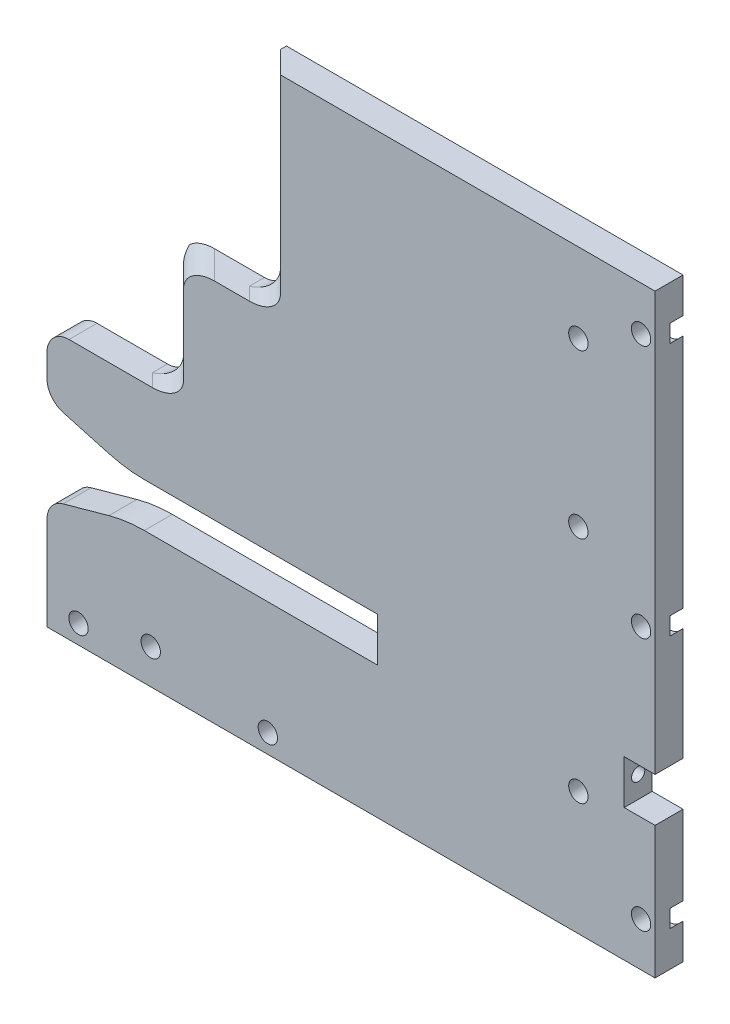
SolidWorks part; units mm, degrees
ref_plane "Front Plane" through (0, 0, 0) normal (0, 0, 1) x (1, 0, 0)
ref_plane "Top Plane" through (0, 0, 0) normal (0, 1, 0) x (1, 0, 0)
ref_plane "Right Plane" through (0, 0, 0) normal (1, 0, 0) x (0, 0, -1)
sketch "Sketch1" plane through (0, 0, 0) normal (0, 0, 1) x (1, 0, 0)
  line L0 (0, 0) -> (-138, 0)
  line L1 (-138, 0) -> (-138, 30)
  line L2 (-138, 30) -> (-63, 30)
  line L3 (-63, 30) -> (-63, 40)
  line L4 (-63, 40) -> (-138, 40)
  line L5 (-138, 40) -> (-138, 59)
  line L6 (-138, 59) -> (-112, 59)
  line L7 (-112, 59) -> (-112, 87)
  line L8 (-112, 87) -> (-90, 87)
  line L9 (-90, 87) -> (-90, 135)
  line L10 (-90, 135) -> (0, 135)
  line L11 (0, 135) -> (0, 0)
  point P10 (-120, 40)
  point P14 (-120, 30)
  dimension "D1" = 30
  dimension "D2" = 138
  dimension "D3" = 75
  dimension "D4" = 10
  dimension "D5" = 19
  dimension "D6" = 26
  dimension "D7" = 28
  dimension "D8" = 135
  dimension "D9" = 22
  dimension "D10" = 18
extrude "Boss-Extrude1" add sketch "Sketch1" along normal blind 6.35
sketch "Sketch4" plane through (0, 0, 0) normal (0, 0, -1) x (-1, 0, 0)
  line L0 (120, 40) -> (138, 45)
  line L1 (138, 40) -> (138, 59) construction
  line L2 (138, 45) -> (138, 40)
  line L3 (138, 40) -> (120, 40)
  line L4 (120, 30) -> (138, 30)
  line L5 (138, 30) -> (138, 25)
  line L6 (138, 0) -> (138, 30) construction
  line L7 (138, 25) -> (120, 30)
  dimension "D1" = 5
  dimension "D2" = 5
extrude "Cut-Extrude1" cut sketch "Sketch4" against normal through all
sketch "Sketch5" plane through (-63, 0, 0) normal (-1, 0, 0) x (0, 0, 1)
  line L0 (6.35, 30) -> (0, 30) construction
  circle A0 centre (3.175, 35) radius 1.5
  point P5 (3.175, 30)
  dimension "D1" = 3
extrude "Cut-Extrude2" cut sketch "Sketch5" against normal through all
fillet "Fillet1" radius 30 2 edges at (-120, 40, 3.175) (-120, 30, 3.175)
chamfer "Chamfer1" distance 5 angle 45 2 edges at (-112, 73, 6.35) (-90, 111, 6.35)
fillet "Fillet2" radius 5 3 edges at (-138, 25, 3.175) (-138, 45, 3.175) (-138, 59, 3.175)
fillet "Fillet3" radius 5 4 edges at (-87.5, 87, 3.85) (-90, 87, 0.675) (-109.5, 59, 3.85) (-112, 59, 0.675)
sketch "Sketch6" plane through (0, 0, 0) normal (0, 0, -1) x (-1, 0, 0)
  line L0 (0, 0) -> (0, 135) construction
  line L1 (0, 40) -> (7, 40)
  line L2 (0, 40) -> (0, 30)
  line L3 (0, 30) -> (7, 30)
  line L4 (7, 40) -> (7, 30)
  line L5 (115.9107, 40) -> (63, 40) construction
  line L6 (63, 30) -> (115.9107, 30) construction
  dimension "D1" = 7
extrude "Cut-Extrude3" cut sketch "Sketch6" against normal through all
sketch "Sketch8" plane through (0, 0, 0) normal (0, 0, -1) x (-1, 0, 0)
  line L0 (0, 40) -> (0, 135) construction
  line L1 (0, 135) -> (90, 135) construction
  line L2 (138, 0) -> (0, 0) construction
  point P0 (3.175, 125)
  point P1 (3.175, 67.5)
  point P2 (3.175, 10)
  dimension "D1" = 3.175
  dimension "D2" = 10
  dimension "D3" = 10
  dimension "D4" = 67.5
hole_wizard "Hole1" positions "Sketch9" profile "Sketch10" legacy
sketch "Sketch9" plane through (0, 0, 0) normal (0, 0, -1) x (-1, 0, 0)
  point P0 (3.175, 125)
  point P3 (3.175, 67.5)
  point P6 (3.175, 10)
sketch "Sketch10" plane through (-3.175, 125, 0) normal (1, 0, 0) x (0, 1, 0)
  line L0 (0, 0) -> (0, 6.35)
  line L1 (0, 6.35) -> (2.2, 6.35)
  line L2 (2.2, 6.35) -> (2.2, 3)
  line L3 (2.2, 3) -> (3.75, 3)
  line L4 (3.75, 3) -> (3.75, 0)
  line L5 (3.75, 0) -> (0, 0)
  line L6 (0, 110) -> (0, -10) construction
  dimension "Diameter" = 4.4
  dimension "Depth" = 6.35
  dimension "C-Bore Diameter" = 7.5
  dimension "C-Bore Depth" = 3
sketch "Sketch11" plane through (0, 0, 0) normal (0, 0, -1) x (-1, 0, 0)
  point P0 (17.4, 117)
  point P1 (17.4, 80)
  point P3 (17.4, 28)
hole_wizard "Hole2" positions "Sketch12" profile "Sketch13" legacy
sketch "Sketch12" plane through (0, 0, 0) normal (0, 0, -1) x (-1, 0, 0)
  point P0 (17.4, 117)
  point P3 (17.4, 80)
  point P6 (17.4, 28)
sketch "Sketch13" plane through (-17.4, 117, 0) normal (1, 0, 0) x (0, 1, 0)
  line L0 (0, 0) -> (0, 6.35)
  line L1 (0, 6.35) -> (2.2, 6.35)
  line L2 (2.2, 6.35) -> (2.2, 3)
  line L3 (2.2, 3) -> (3.75, 3)
  line L4 (3.75, 3) -> (3.75, 0)
  line L5 (3.75, 0) -> (0, 0)
  line L6 (0, 110) -> (0, -10) construction
  dimension "Diameter" = 4.4
  dimension "Depth" = 6.35
  dimension "C-Bore Diameter" = 7.5
  dimension "C-Bore Depth" = 3
fillet "Fillet4" radius 5 1 edges at (-109.5, 87, 3.85)
hole_wizard "Hole3" positions "Sketch14" profile "Sketch15" legacy
sketch "Sketch14" plane through (0, 0, 0) normal (0, 0, -1) x (-1, 0, 0)
  point P0 (87.8704, 4.2936)
  point P3 (114.4514, 7.9069)
  point P6 (130.845, 4.2936)
sketch "Sketch15" plane through (-87.8704, 4.2936, 0) normal (1, 0, 0) x (0, 1, 0)
  line L0 (0, 0) -> (0, 6.35)
  line L1 (0, 6.35) -> (2.2, 6.35)
  line L2 (2.2, 6.35) -> (2.2, 3)
  line L3 (2.2, 3) -> (3.75, 3)
  line L4 (3.75, 3) -> (3.75, 0)
  line L5 (3.75, 0) -> (0, 0)
  line L6 (0, 110) -> (0, -10) construction
  dimension "Diameter" = 4.4
  dimension "Depth" = 6.35
  dimension "C-Bore Diameter" = 7.5
  dimension "C-Bore Depth" = 3
